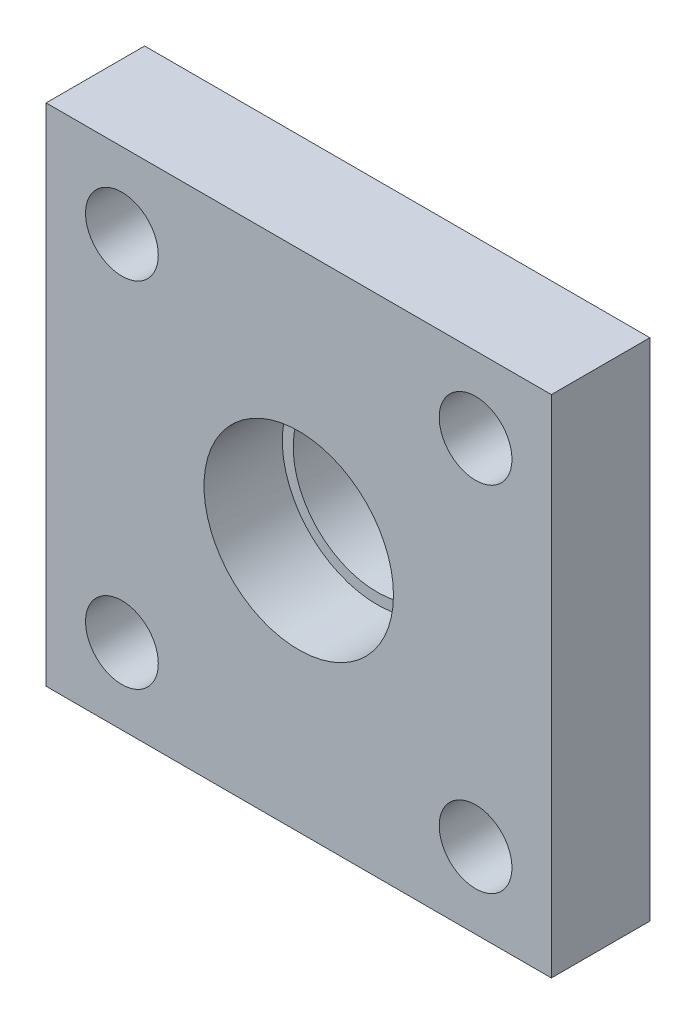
SolidWorks part; units mm, degrees
ref_plane "Front Plane" through (0, 0, 0) normal (0, 0, 1) x (1, 0, 0)
ref_plane "Top Plane" through (0, 0, 0) normal (0, 1, 0) x (1, 0, 0)
ref_plane "Right Plane" through (0, 0, 0) normal (1, 0, 0) x (0, 0, -1)
sketch "Sketch46" plane through (0, 0, 0) normal (0, 0, 1) x (1, 0, 0)
  circle A0 centre (24.6888, 2.0701) radius 4.2164
  dimension "D1" = 8.4328
  dimension "D2" = 24.6888
  dimension "D3" = 2.0701
sketch "Sketch49" plane through (0, 0, 0) normal (0, 0, 1) x (1, 0, 0)
  line L1 (24.6888, 2.0701) -> (15.7988, 10.9601) construction
  line L2 (24.6888, 2.0701) -> (4.1649, 2.0701) construction
  circle A0 centre (15.7988, 10.9601) radius 1.8288
  circle A1 centre (33.5788, 10.9601) radius 1.8288
  circle A2 centre (33.5788, -6.8199) radius 1.8288
  circle A3 centre (15.7988, -6.8199) radius 1.8288
  circle A5 centre (24.6888, 2.0701) radius 4.2164 construction
  dimension "D1" = 3.6576
  dimension "D2" = 45
  dimension "D3" = 8.89
  dimension "D4" = 8.89
  dimension "D5" = 8.89
sketch "Sketch50" plane through (0, 0, 0) normal (0, 0, 1) x (1, 0, 0)
  line L1 (11.9888, 14.7701) -> (37.3888, 14.7701)
  line L2 (11.9888, 14.7701) -> (11.9888, -10.6299)
  line L3 (11.9888, -10.6299) -> (37.3888, -10.6299)
  line L4 (37.3888, 14.7701) -> (37.3888, -10.6299)
  dimension "D1" = 25.4
  dimension "D2" = 25.4
  dimension "D3" = 12.7
  dimension "D4" = 12.7
sketch "Sketch51" plane through (0, 0, 0) normal (0, 0, 1) x (1, 0, 0)
  circle A0 centre (24.6888, 2.0701) radius 4.7625
  dimension "D1" = 9.525
sketch "Sketch52" plane through (0, 0, 0) normal (0, 0, 1) x (1, 0, 0)
  line L5 (18.3388, 8.4201) -> (31.0388, 8.4201)
  line L6 (18.3388, 8.4201) -> (18.3388, -4.2799)
  line L7 (18.3388, -4.2799) -> (31.0388, -4.2799)
  line L8 (31.0388, 8.4201) -> (31.0388, -4.2799)
  dimension "D5" = 12.7
  dimension "D6" = 12.7
extrude "Extrude1" add sketch "Sketch52" against normal blind 4.572
extrude "Extrude2" add sketch "Sketch50" along normal blind 4.953
extrude "Cut-Extrude2" cut sketch "Sketch49" along normal through all
sketch "Sketch53" plane through (0, 0, 0) normal (0, 0, 1) x (1, 0, 0)
  circle A0 centre (24.6888, 2.0701) radius 4.2164
extrude "Cut-Extrude3" cut sketch "Sketch53" along normal through all from surface at -4.572
extrude "Cut-Extrude4" cut sketch "Sketch51" against normal blind 3.937 from surface at 4.953
